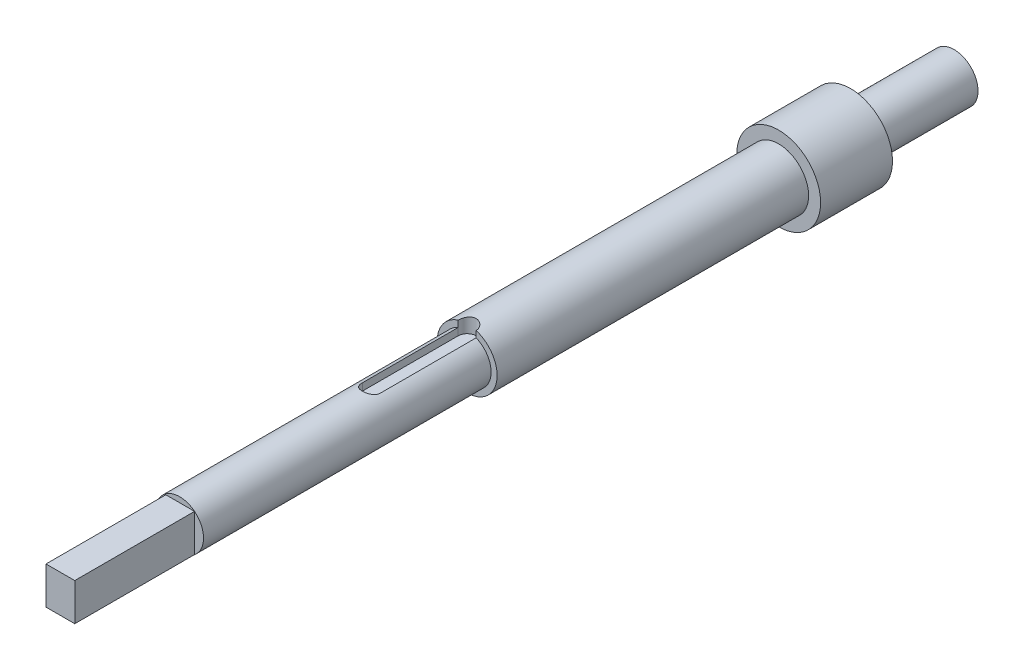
SolidWorks part; units mm, degrees
ref_plane "Front Plane" through (0, 0, 0) normal (0, 0, 1) x (1, 0, 0)
ref_plane "Top Plane" through (0, 0, 0) normal (0, 1, 0) x (1, 0, 0)
ref_plane "Right Plane" through (0, 0, 0) normal (1, 0, 0) x (0, 0, -1)
sketch "Sketch3" plane through (0, 0, 0) normal (0, 0, 1) x (1, 0, 0)
  circle A0 centre (0, 0) radius 6.35
  dimension "D1" = 12.7
extrude "Boss-Extrude1" add sketch "Sketch3" along normal blind 76.2
ref_plane "Plane1" through (0, 6.35, 0) normal (0, 1, 0) x (1, 0, 0)
sketch "Sketch5" plane through (0, 0, 0) normal (0, 0, -1) x (-1, 0, 0)
  circle A0 centre (0, 0) radius 7.9375
  dimension "D1" = 15.875
extrude "Boss-Extrude2" add sketch "Sketch5" along normal blind 82.55
sketch "Sketch6" plane through (0, 0, -82.55) normal (0, 0, -1) x (-1, 0, 0)
  circle A0 centre (0, 0) radius 11.1125
  dimension "D1" = 22.225
extrude "Boss-Extrude3" add sketch "Sketch6" along normal blind 19.05
sketch "Sketch9" plane through (0, 0, 76.2) normal (0, 0, 1) x (1, 0, 0)
  line L1 (-3.6513, 4.957) -> (3.9688, 4.957)
  line L2 (-3.6513, 4.957) -> (-3.6512, -4.957)
  line L3 (-3.6512, -4.957) -> (3.9688, -4.957)
  line L4 (3.9688, 4.957) -> (3.9688, -4.957)
  circle A0 centre (0, 0) radius 6.35 construction
  point P0 (0, 0)
  dimension "D1" = 7.62
extrude "Boss-Extrude4" add sketch "Sketch9" along normal blind 31.75
sketch "Sketch4" plane through (0, 6.35, 0) normal (0, 1, 0) x (1, 0, 0)
  line L0 (0, 0) -> (0, -25.4) construction
  line L1 (2.3813, 0) -> (2.3812, -25.4)
  line L2 (-2.3813, 0) -> (-2.3812, -25.4)
  arc A0 (2.3813, 0) -> (-2.3813, 0) centre (0, 0) ccw
  arc A1 (-2.3812, -25.4) -> (2.3812, -25.4) centre (0, -25.4) ccw
  point P3 (0, -12.7)
  dimension "D1" = 25.4
  dimension "D2" = 0
  dimension "D3" = 4.7625
extrude "Cut-Extrude1" cut sketch "Sketch4" against normal blind 2.3813 and the other way through all
sketch "Sketch10" plane through (0, 0, -101.6) normal (0, 0, -1) x (-1, 0, 0)
  circle A0 centre (0, 0) radius 6.35
  dimension "D1" = 12.7
extrude "Boss-Extrude5" add sketch "Sketch10" along normal blind 27.432
